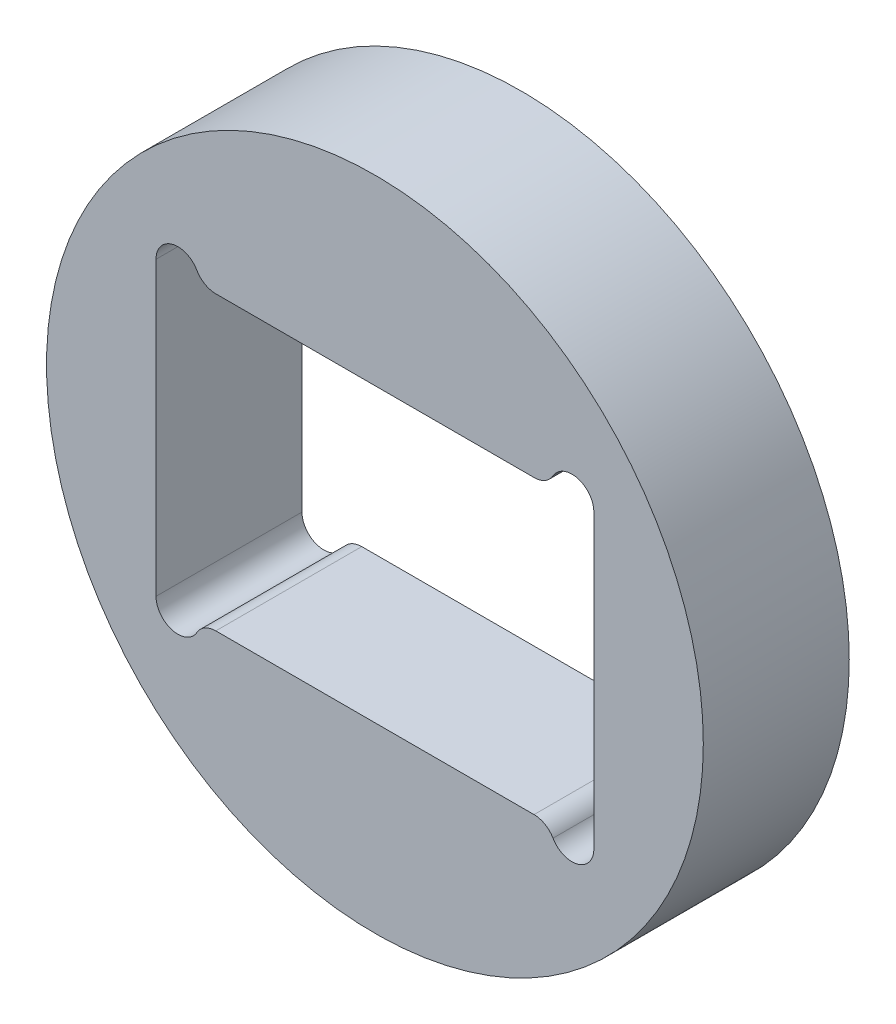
SolidWorks part; units mm, degrees
ref_plane "Plan de face" through (0, 0, 0) normal (0, 0, 1) x (1, 0, 0)
ref_plane "Plan de dessus" through (0, 0, 0) normal (0, 1, 0) x (1, 0, 0)
ref_plane "Plan de droite" through (0, 0, 0) normal (1, 0, 0) x (0, 0, -1)
sketch "Esquisse1" plane through (0, 0, 0) normal (0, 0, 1) x (1, 0, 0)
  line L0 (-47.0465, 30.0201) -> (-47.0465, 10.0201)
  line L1 (-51.1446, 10.0201) -> (-72.9484, 10.0201)
  line L2 (-77.0465, 10.0201) -> (-77.0465, 30.0201)
  line L3 (-72.9484, 30.0201) -> (-51.1446, 30.0201)
  arc A0 (-51.1446, 30.0201) -> (-49.8455, 30.7701) centre (-51.1446, 31.5201) ccw
  arc A1 (-47.0465, 30.0201) -> (-49.8455, 30.7701) centre (-48.5465, 30.0201) ccw
  arc A2 (-49.8455, 9.2701) -> (-47.0465, 10.0201) centre (-48.5465, 10.0201) ccw
  arc A3 (-49.8455, 9.2701) -> (-51.1446, 10.0201) centre (-51.1446, 8.5201) ccw
  arc A4 (-72.9484, 10.0201) -> (-74.2474, 9.2701) centre (-72.9484, 8.5201) ccw
  arc A5 (-77.0465, 10.0201) -> (-74.2474, 9.2701) centre (-75.5465, 10.0201) ccw
  arc A6 (-74.2474, 30.7701) -> (-77.0465, 30.0201) centre (-75.5465, 30.0201) ccw
  arc A7 (-74.2474, 30.7701) -> (-72.9484, 30.0201) centre (-72.9484, 31.5201) ccw
  circle A8 centre (-62.0465, 20.0201) radius 22.5
  dimension "D4" = 45
  dimension "D5" = 1.5
  dimension "D6" = 1.5
  dimension "D7" = 1.5
  dimension "D8" = 1.5
  dimension "D9" = 1.5
  dimension "D10" = 1.5
  dimension "D11" = 1.5
  dimension "D12" = 1.5
  dimension "D13" = 15
  dimension "D1" = 30
  dimension "D2" = 20
  dimension "D3" = 10
extrude "Boss.-Extru.1" add sketch "Esquisse1" along normal blind 10
